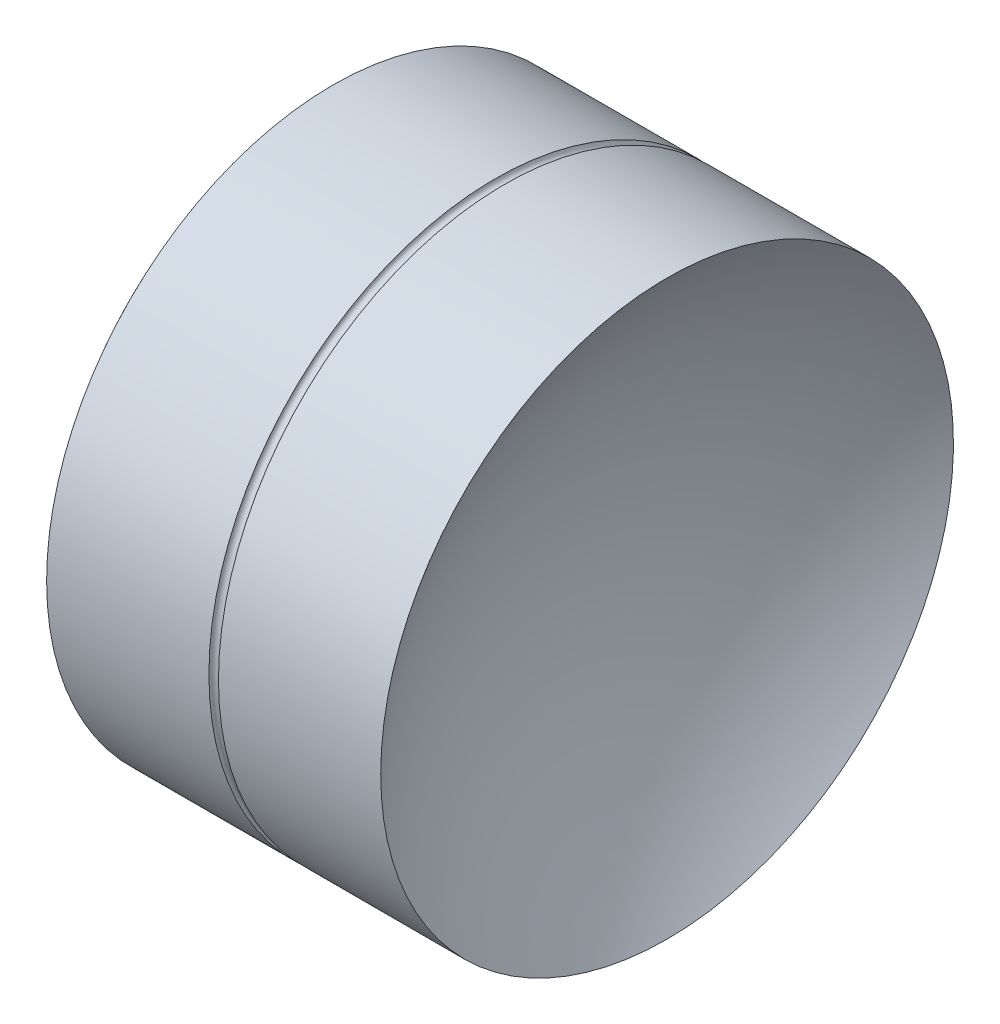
SolidWorks part; units mm, degrees
ref_plane "Face" through (0, 0, 0) normal (0, 0, 1) x (1, 0, 0)
ref_plane "Dessus" through (0, 0, 0) normal (0, 1, 0) x (1, 0, 0)
ref_plane "Droite" through (0, 0, 0) normal (1, 0, 0) x (0, 0, -1)
sketch "Esquisse1" plane through (0, 0, 0) normal (0, 0, 1) x (1, 0, 0)
  line L0 (-64.5123, 0) -> (40.4173, 0) construction
  line L1 (6.2229, 0) -> (9.7229, 0)
  line L2 (7.2229, 3) -> (8.9229, 3)
  line L3 (9.0229, 3) -> (10.7229, 3)
  arc A0 (7.2229, 3) -> (6.2229, 0) centre (11.2229, 0) ccw
  arc A1 (10.7229, 3) -> (9.7229, 0) centre (14.7229, 0) ccw
  arc A2 (8.9229, 3) -> (9.0229, 3) centre (8.9729, 3) ccw
  dimension "D1" = 10
  dimension "D2" = 10
  dimension "D4" = 0.1
  dimension "D6" = 1.75
  dimension "D3" = 3.5
  dimension "D5" = 3
revolve "Révolution1" add sketch "Esquisse1" angle 360 about L0
